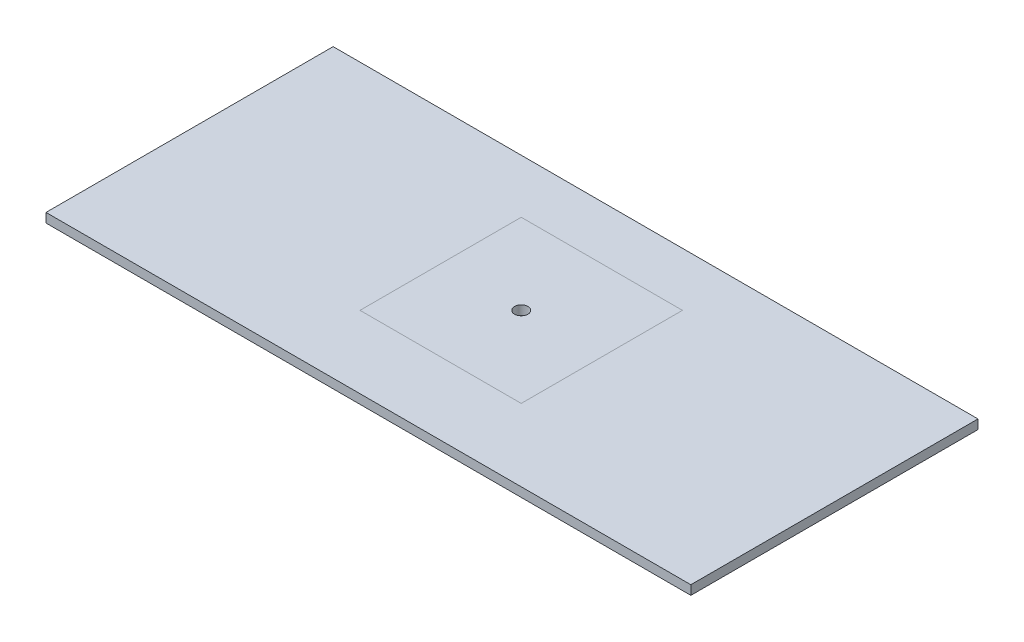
SolidWorks part; units mm, degrees
ref_plane "Front Plane" through (0, 0, 0) normal (0, 0, 1) x (1, 0, 0)
ref_plane "Top Plane" through (0, 0, 0) normal (0, 1, 0) x (1, 0, 0)
ref_plane "Right Plane" through (0, 0, 0) normal (1, 0, 0) x (0, 0, -1)
sketch "Sketch1" plane through (0, 0, 0) normal (0, 0, 1) x (1, 0, 0)
  line L1 (-609.6, -8.7312) -> (609.6, -8.7312)
  line L2 (-609.6, -8.7312) -> (-609.6, 8.7312)
  line L3 (-609.6, 8.7312) -> (609.6, 8.7312)
  line L4 (609.6, -8.7312) -> (609.6, 8.7312)
  line L5 (-609.6, -8.7312) -> (609.6, 8.7312) construction
  line L6 (-609.6, 8.7312) -> (609.6, -8.7312) construction
  point P0 (0, 0)
  dimension "D1" = 17.4625
  dimension "D2" = 1219.2
extrude "Boss-Extrude1" add sketch "Sketch1" along normal blind 542.925 contours L3 L4 L1 L2
sketch "Sketch2" plane through (0, 8.7312, 0) normal (0, 1, 0) x (1, 0, 0)
  line L0 (0, 0) -> (0, -542.925) construction
  line L1 (-609.6, -542.925) -> (609.6, -542.925) construction
  circle A0 centre (0, -254) radius 12.7
  dimension "D1" = 25.4
  dimension "D2" = 288.925
extrude "Cut-Extrude1" cut sketch "Sketch2" against normal through all
sketch "Sketch3" plane through (0, 8.7312, 0) normal (0, 1, 0) x (1, 0, 0)
  line L1 (-152.4, -406.4) -> (152.4, -406.4)
  line L2 (-152.4, -406.4) -> (-152.4, -101.6)
  line L3 (-152.4, -101.6) -> (152.4, -101.6)
  line L4 (152.4, -406.4) -> (152.4, -101.6)
  line L5 (-152.4, -406.4) -> (152.4, -101.6) construction
  line L6 (-152.4, -101.6) -> (152.4, -406.4) construction
  circle A0 centre (0, -254) radius 12.7 construction
  circle A1 centre (0, -254) radius 12.7
  dimension "D1" = 304.8
extrude "Cut-Extrude2" cut sketch "Sketch3" against normal blind 0.0003
